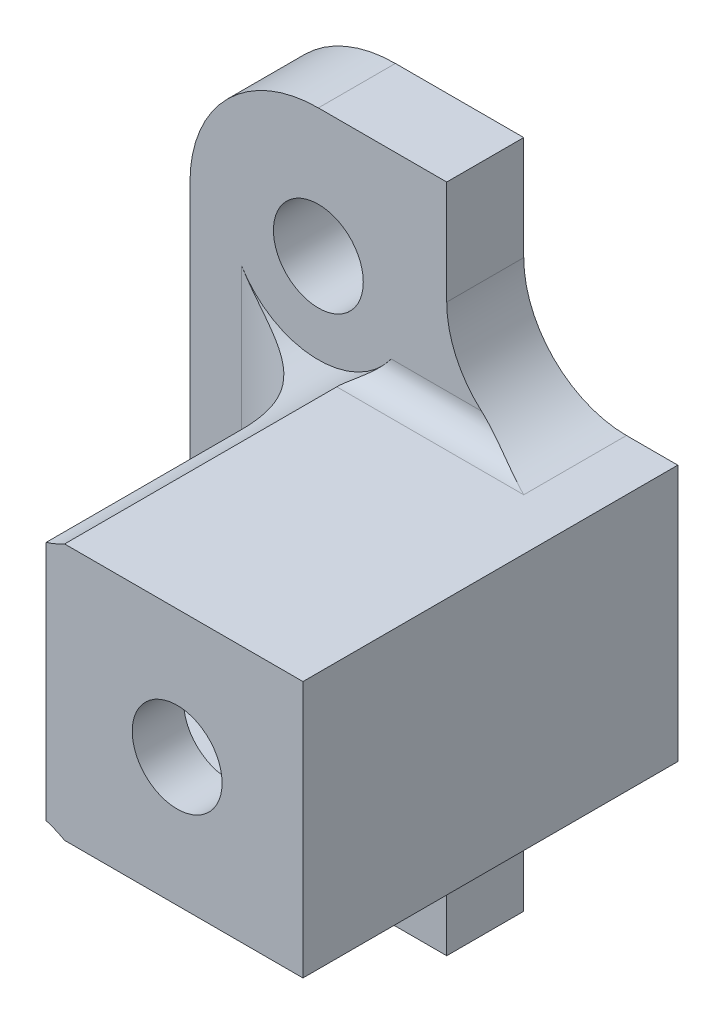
SolidWorks part; units mm, degrees
ref_plane "Front Plane" through (0, 0, 0) normal (0, 0, 1) x (1, 0, 0)
ref_plane "Top Plane" through (0, 0, 0) normal (0, 1, 0) x (1, 0, 0)
ref_plane "Right Plane" through (0, 0, 0) normal (1, 0, 0) x (0, 0, -1)
sketch "Sketch1" plane through (0, 0, 0) normal (0, 0, 1) x (1, 0, 0)
  line L1 (-5.5983, 15.5867) -> (4.4017, 15.5867)
  line L2 (-5.5983, 15.5867) -> (-5.5983, -10.5133)
  line L3 (-5.5983, -10.5133) -> (4.4017, -10.5133)
  line L4 (4.4017, 15.5867) -> (4.4017, -10.5133)
  circle A0 centre (-0.5983, 10.5867) radius 1.75
  circle A1 centre (-0.5983, -5.5133) radius 1.75
  point P8 (-0.5983, -10.5133)
  dimension "D3" = 3.5
  dimension "D4" = 3.5
  dimension "D1" = 10
  dimension "D2" = 5
  dimension "D5" = 5
  dimension "D6" = 5
  dimension "D7" = 16.1
  dimension "D8" = 5
extrude "Boss-Extrude1" add sketch "Sketch1" along normal blind 3
fillet "Fillet1" radius 5 2 edges at (-5.5983, -10.5133, 1.5) (-5.5983, 15.5867, 1.5)
ref_plane "Plane1" through (0, 0, 3) normal (0, 0, 1) x (1, 0, 0)
sketch "Sketch2" plane through (0, 0, 3) normal (0, 0, 1) x (1, 0, 0)
  line L1 (0.4017, 7.5367) -> (10.4017, 7.5367)
  line L2 (0.4017, 7.5367) -> (0.4017, -2.4633)
  line L3 (0.4017, -2.4633) -> (10.4017, -2.4633)
  line L4 (10.4017, 7.5367) -> (10.4017, -2.4633)
  line L5 (4.4017, 15.5867) -> (-0.5983, 15.5867) construction
  line L6 (4.4017, -10.5133) -> (4.4017, 15.5867) construction
  point P4 (1.6575, -2.4633)
  point P8 (1.9017, 15.5867)
  point P9 (0, 0)
  dimension "D1" = 10
  dimension "D2" = 8.05
  dimension "D3" = 10
  dimension "D4" = 4
extrude "Extrude-Thin1" add sketch "Sketch2" along normal blind 11.6 and the other way up to surface thin
ref_plane "Plane2" through (0, 0, 14.6) normal (0, 0, 1) x (1, 0, 0)
fillet "Fillet4" radius 1 2 edges at (2.4017, -2.4633, 3) (2.4017, 7.5367, 3)
sketch "Sketch10" plane through (0, 0, 14.6) normal (0, 0, 1) x (1, 0, 0)
  line L0 (0.4017, -2.4633) -> (4.4017, -2.4633) construction
  line L1 (0.4017, 7.5367) -> (10.4017, 7.5367)
  line L2 (0.4017, 7.5367) -> (0.4017, -2.4633)
  line L3 (0.4017, -2.4633) -> (10.4017, -2.4633)
  line L4 (10.4017, 7.5367) -> (10.4017, -2.4633)
  line L5 (0.4017, 8.5367) -> (0.4017, -3.4633) construction
  point P4 (0, 0)
  point P5 (0, 0)
  point P8 (0, 0)
  point P9 (0.4017, 7.5367)
  point P11 (0.4017, -2.4633)
extrude "Boss-Extrude4" add sketch "Sketch10" against normal blind 7
ref_plane "Plane4" through (0, 0, 12.6) normal (0, 0, 1) x (1, 0, 0)
sketch "Sketch12" plane through (0, 0, 12.6) normal (0, 0, 1) x (1, 0, 0)
  line L0 (0.4017, 7.5367) -> (0.4017, -2.4633) construction
  line L1 (0.4017, 5.4367) -> (8.8017, 5.4367)
  line L2 (0.4017, 5.4367) -> (0.4017, -0.3633)
  line L3 (0.4017, -0.3633) -> (8.8017, -0.3633)
  line L4 (8.8017, 5.4367) -> (8.8017, -0.3633)
  line L5 (10.4017, 7.5367) -> (0.4017, 7.5367) construction
  dimension "D1" = 2.1
  dimension "D2" = 8.4
extrude "Cut-Extrude5" cut sketch "Sketch12" against normal blind 2.8
sketch "Sketch8" plane through (0, 0, 14.6) normal (0, 0, 1) x (1, 0, 0)
  circle A1 centre (-0.5983, 10.5867) radius 3.5
  circle A2 centre (-0.5983, -5.5133) radius 3.5
  dimension "D3" = 7
  dimension "D4" = 7
extrude "Cut-Extrude3" cut sketch "Sketch8" against normal up to surface (11.6 mm away)
sketch "Sketch13" plane through (0, 0, 14.6) normal (0, 0, 1) x (1, 0, 0)
  line L1 (1.1185, 7.5367) -> (10.4017, 7.5367) construction
  line L3 (0.4017, 7.2326) -> (0.4017, -2.1592) construction
  circle A0 centre (5.5017, 2.5367) radius 1.75
  dimension "D1" = 3.5
  dimension "D2" = 5.1
  dimension "D3" = 5
extrude "Cut-Extrude6" cut sketch "Sketch13" against normal blind 15.8
fillet "Fillet5" radius 4 3 edges at (4.4017, -2.4633, 2) (4.4017, 7.5367, 2) (0.4017, 2.5367, 3)
